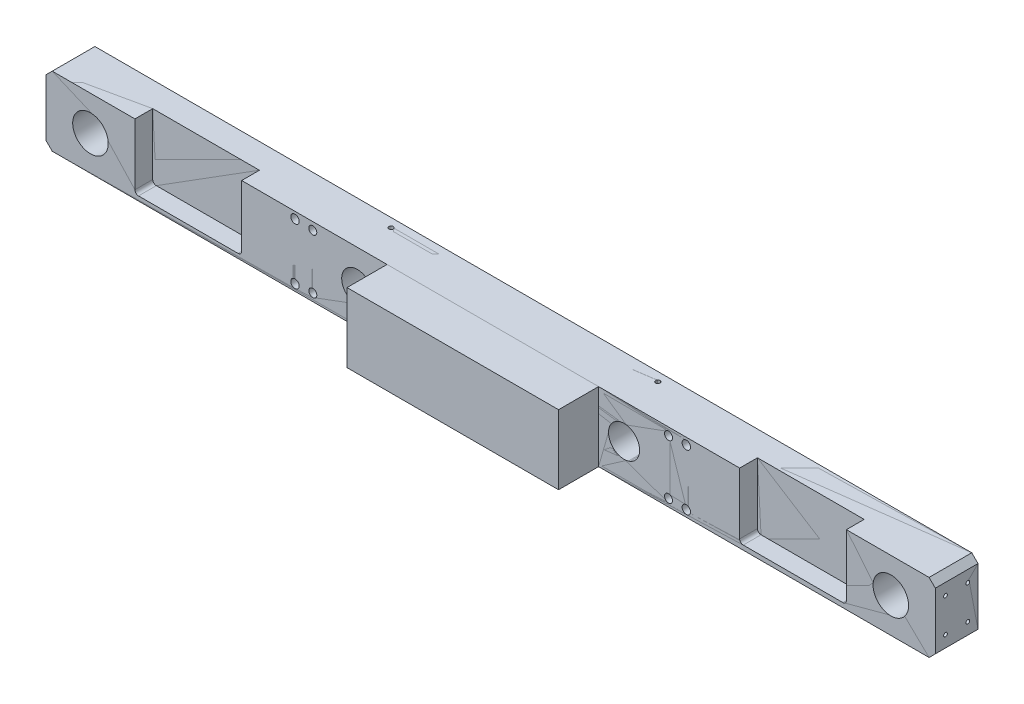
SolidWorks part; units mm, degrees
ref_plane "Face" through (0, 0, 0) normal (0, 0, 1) x (1, 0, 0)
ref_plane "Dessus" through (0, 0, 0) normal (0, 1, 0) x (1, 0, 0)
ref_plane "Droite" through (0, 0, 0) normal (1, 0, 0) x (0, 0, -1)
imported_body "Importée1"
sketch "Esquisse1" plane through (0, 0, 0) normal (0, 0, 1) x (1, 0, 0)
  line L0 (740, 78) -> (180, 78) construction
  line L1 (343.4824, 78) -> (581.3383, 78)
  line L2 (343.4824, 78) -> (343.4824, 0)
  line L3 (343.4824, 0) -> (581.3383, 0)
  line L4 (581.3383, 78) -> (581.3383, 0)
  line L5 (-33, 0) -> (953, 0) construction
extrude "Extrusion1" add sketch "Esquisse1" along normal blind 45
